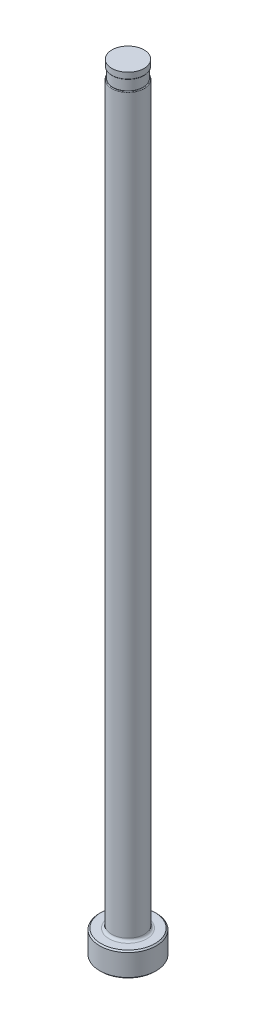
SolidWorks part; units mm, degrees
ref_plane "Front Plane" through (0, 0, 0) normal (0, 0, 1) x (1, 0, 0)
ref_plane "Top Plane" through (0, 0, 0) normal (0, 1, 0) x (1, 0, 0)
ref_plane "Right Plane" through (0, 0, 0) normal (1, 0, 0) x (0, 0, -1)
other "Configuration Table"
sketch "Sketch1" plane through (0, 0, 0) normal (0, 0, 1) x (1, 0, 0)
  line L0 (0, 259.9588) -> (0, -15.1925) construction
  line L1 (0, 0) -> (-5.5499, 0)
  line L2 (-5.5499, 0) -> (-5.5499, 4.7498)
  line L3 (-5.5499, 4.7498) -> (-3.175, 4.7498)
  line L4 (-3.175, 4.7498) -> (-3.175, 152.4)
  line L5 (-3.175, 152.4) -> (0, 152.4)
  line L6 (0, 152.4) -> (0, 0)
  dimension "L" = 152.4
  dimension "H" = 11.0998
  dimension "T" = 4.7498
  dimension "D" = 6.35
revolve "Revolve1" add sketch "Sketch1" angle 360 about L0
chamfer "Chamfer1" distance 0.254 angle 45 2 edges at (0, 4.7498, 5.5499) (0, 0, 5.5499)
fillet "Fillet1" radius 0.508 1 edges at (0, 4.7498, 3.175)
sketch "Sketch2" plane through (0, 0, 0) normal (0, 0, 1) x (1, 0, 0)
  line L0 (-3.175, 152.4) -> (-3.175, 5.2578) construction
  line L1 (-3.175, 151.13) -> (-2.9718, 151.13)
  line L2 (-3.175, 151.13) -> (-3.175, 149.098)
  line L3 (-3.175, 149.098) -> (-2.9718, 149.098)
  line L4 (-2.9718, 151.13) -> (-2.9718, 149.098)
  line L5 (3.175, 152.4) -> (-3.175, 152.4) construction
  line L6 (0, 153.4483) -> (0, 147.3282) construction
  dimension "D1" = 2.032
  dimension "N" = 1.27
  dimension "FD" = 0.2032
  dimension "D3" = 5.9436
revolve "Vent Relief" cut sketch "Sketch2" angle 360 about L6
sketch "Sketch3" plane through (0, 0, 0) normal (0, 0, 1) x (1, 0, 0)
  line L0 (-2.9718, 150.114) -> (-2.9718, 86.614)
  line L1 (-2.9718, 151.13) -> (-2.9718, 149.098) construction
  line L2 (-3.175, 149.098) -> (-3.175, 5.2578) construction
  line L3 (-3.175, 85.4964) -> (-3.175, 150.114)
  line L4 (-3.175, 150.114) -> (-2.9718, 150.114)
  arc A0 (-2.9718, 86.614) -> (-3.175, 85.4964) centre (-6.1468, 86.614) cw
  dimension "D1" = 3.175
  dimension "D2" = 63.5
extrude "D-Slot" cut sketch "Sketch3" against normal through all both and the other way through all
sketch "Sketch5" plane through (0, 0, 0) normal (0, 0, 1) x (1, 0, 0)
  line L0 (-3.175, 151.13) -> (3.175, 151.13) construction
  line L1 (-3.175, 152.4) -> (-3.1559, 152.4)
  line L2 (-3.175, 152.4) -> (-3.175, 151.13)
  line L3 (-3.175, 151.13) -> (-3.1559, 151.13)
  line L4 (-3.1559, 152.4) -> (-3.1559, 151.13)
  line L5 (0, 152.6877) -> (0, 150.5771) construction
  dimension "VP" = 0.019
revolve "Vent Diameter" cut sketch "Sketch5" angle 360 about L5
fillet "Fillet2" radius 0.127 2 edges at (3.175, 149.098, 0) (0, 151.13, 3.1559)
sketch "Pocket Sketch" plane through (0, 0, 0) normal (0, 0, 1) x (1, 0, 0)
  line L0 (-5.9468, 0) -> (-5.9468, 4.7752)
  line L1 (-5.9468, 4.7752) -> (-4.1354, 4.7752)
  line L2 (-3.3734, 5.5372) -> (-3.3734, 22.225)
  line L3 (-3.3734, 22.225) -> (0, 22.225)
  line L4 (0, 22.225) -> (0, 0)
  line L5 (0, 0) -> (-5.9468, 0)
  line L6 (0, 12.6104) -> (0, -2.4989) construction
  line L7 (-5.5499, 4.4958) -> (-5.5499, 0.254) construction
  line L8 (5.2959, 4.7498) -> (-5.2959, 4.7498) construction
  line L9 (-3.175, 85.4964) -> (-3.175, 5.2578) construction
  line L10 (-4.1354, 4.7752) -> (-3.3734, 5.5372)
  point P3 (-3.3734, 4.7752)
  dimension "D1" = 11.8935
  dimension "D2" = 0.3969
  dimension "D3" = 0.0254
  dimension "D4" = 0.1984
  dimension "D5" = 6.7469
  dimension "D6" = 22.225
